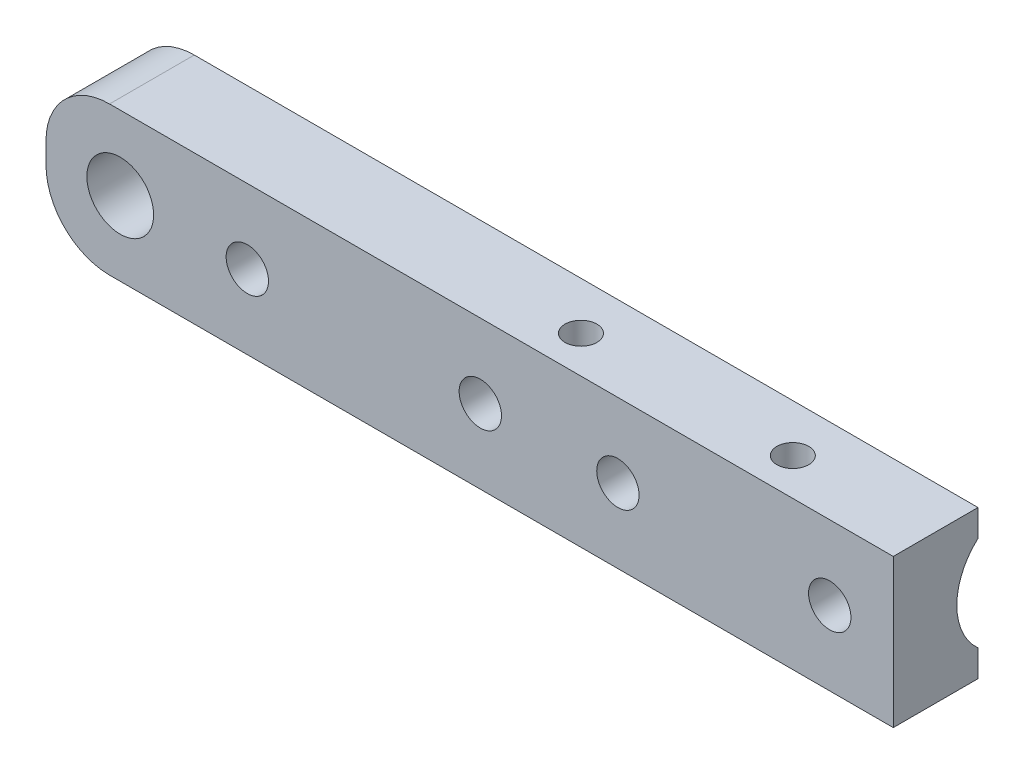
SolidWorks part; units mm, degrees
ref_plane "Front Plane" through (0, 0, 0) normal (0, 0, 1) x (1, 0, 0)
ref_plane "Top Plane" through (0, 0, 0) normal (0, 1, 0) x (1, 0, 0)
ref_plane "Right Plane" through (0, 0, 0) normal (1, 0, 0) x (0, 0, -1)
sketch "Sketch1" plane through (0, 0, 0) normal (0, 0, 1) x (1, 0, 0)
  line L0 (0, 0) -> (115.8748, 0) construction
  line L1 (-11.1252, -11.1125) -> (115.8748, -11.1125)
  line L2 (115.8748, -11.1125) -> (115.8748, 11.1125)
  line L3 (115.8748, 11.1125) -> (-11.1252, 11.1125)
  line L4 (-11.1252, 11.1125) -> (-11.1252, -11.1125)
  circle A0 centre (0, 0) radius 5.0038
  circle A1 centre (106.3498, 0) radius 3.175
  circle A2 centre (74.5998, 0) radius 3.175
  circle A3 centre (19.05, 0) radius 3.175
  circle A4 centre (53.975, 0) radius 3.175
  dimension "D4" = 10.0076
  dimension "D5" = 6.35
  dimension "D8" = 6.35
  dimension "D1" = 11.1252
  dimension "D2" = 22.225
  dimension "D3" = 127
  dimension "D6" = 31.75
  dimension "D7" = 9.525
  dimension "D9" = 19.05
  dimension "D10" = 34.925
extrude "Boss-Extrude1" add sketch "Sketch1" along normal mid plane 12.7
fillet "Fillet1" radius 9.525 2 edges at (-11.1252, -11.1125, 0) (-11.1252, 11.1125, 0)
sketch "Sketch2" plane through (115.8748, 0, 0) normal (1, 0, 0) x (0, 0, -1)
  circle A0 centre (12.7, 0) radius 9.525
  dimension "D1" = 19.05
  dimension "D2" = 12.7
extrude "Cut-Extrude1" cut sketch "Sketch2" against normal blind 50.8
sketch "Sketch3" plane through (0, 0, 0) normal (0, 1, 0) x (1, 0, 0)
  circle A0 centre (63.5, -0.7874) radius 2.3876
  circle A1 centre (95.25, -0.7874) radius 2.3876
  dimension "D1" = 4.7752
  dimension "D2" = 31.75
  dimension "D3" = 63.5
  dimension "D4" = 0.7874
extrude "Cut-Extrude2" cut sketch "Sketch3" along normal mid plane 25.4
